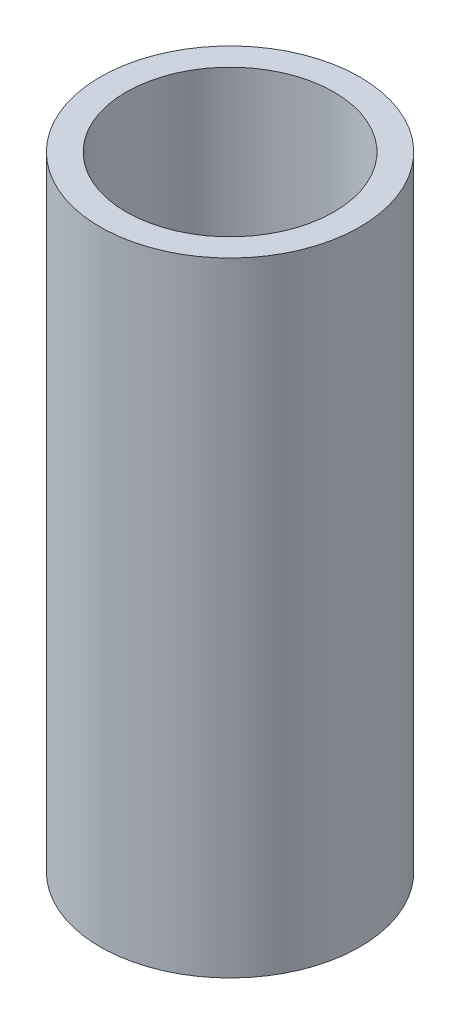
SolidWorks part; units mm, degrees
ref_plane "Front Plane" through (0, 0, 0) normal (0, 0, 1) x (1, 0, 0)
ref_plane "Top Plane" through (0, 0, 0) normal (0, 1, 0) x (1, 0, 0)
ref_plane "Right Plane" through (0, 0, 0) normal (1, 0, 0) x (0, 0, -1)
sketch "Sketch1" plane through (0, 0, 0) normal (0, 1, 0) x (1, 0, 0)
  circle A0 centre (0, 0) radius 12.7
  circle A1 centre (0, 0) radius 15.875
  dimension "D1" = 25.4
  dimension "D2" = 31.75
extrude "Boss-Extrude1" add sketch "Sketch1" along normal blind 76.2
